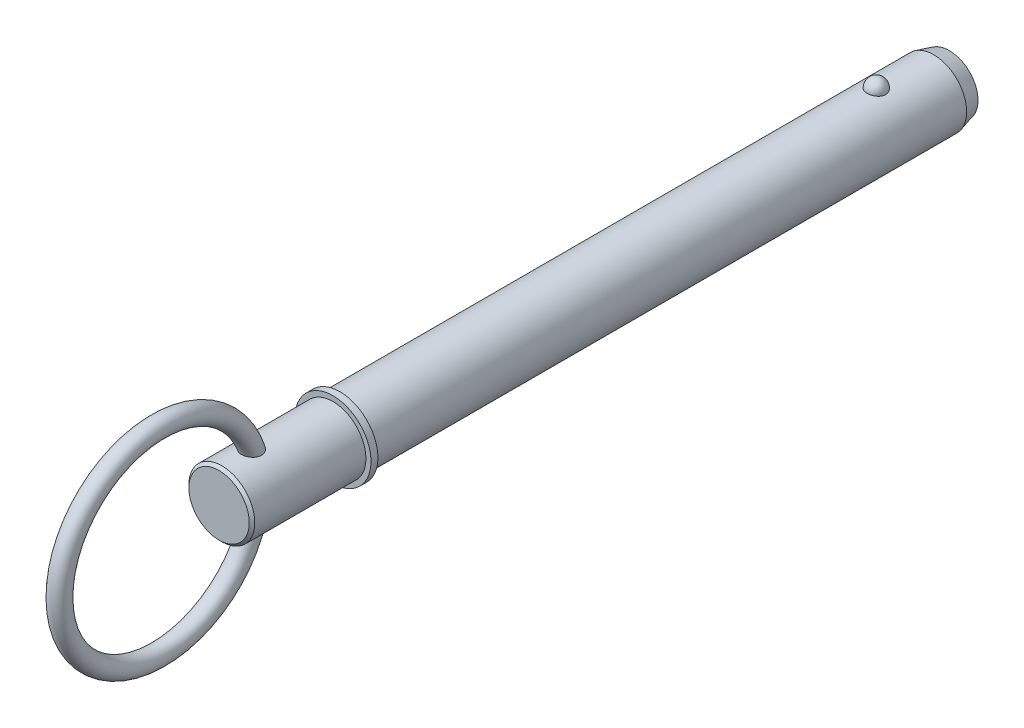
SolidWorks part; units mm, degrees
ref_plane "Front Plane" through (0, 0, 0) normal (0, 0, 1) x (1, 0, 0)
ref_plane "Top Plane" through (0, 0, 0) normal (0, 1, 0) x (1, 0, 0)
ref_plane "Right Plane" through (0, 0, 0) normal (1, 0, 0) x (0, 0, -1)
sketch "Sketch2" plane through (0, 0, 0) normal (0, 0, 1) x (1, 0, 0)
  circle A0 centre (0, 0) radius 9.525
  point P3 (0, 9.525)
  dimension "D1" = 19.05
extrude "Boss-Extrude1" add sketch "Sketch2" along normal blind 152.4
sketch "Sketch3" plane through (0, 0, 0) normal (0, 0, -1) x (-1, 0, 0)
  circle A0 centre (0, 0) radius 9.525
  dimension "D1" = 19.05
extrude "Boss-Extrude2" add sketch "Sketch3" along normal blind 23.8
chamfer "Chamfer1" distance 4.5 angle 15 1 edges at (-9.525, 0, -23.8)
sketch "Sketch18" plane through (0, 0, 0) normal (1, 0, 0) x (0, 0, -1)
  line L0 (19.3, 9.525) -> (-152.4, 9.525) construction
  line L1 (2.69, 12.215) -> (2.69, 6.835)
  line L2 (-152.4, -9.525) -> (19.3, -9.525) construction
  arc A0 (2.69, 12.215) -> (2.69, 6.835) centre (2.69, 9.525) ccw
  point P4 (0, 9.525)
  dimension "D1" = 21.74
revolve "Revolve1" add sketch "Sketch18" angle 360 about L1
sketch "Sketch19" plane through (0, 0, 0) normal (1, 0, 0) x (0, 0, -1)
  line L0 (-33.7288, 0) -> (-46.4542, 0) construction
sketch "Sketch20" plane through (0, 0, 0) normal (1, 0, 0) x (0, 0, -1)
  line L0 (-152.4, 0) -> (-152.4, 11)
  line L1 (-152.4, 9.525) -> (-152.4, -9.525) construction
  line L2 (-152.4, 11) -> (-154.4, 11)
  line L3 (-154.4, 11) -> (-154.4, 0)
  line L4 (-33.7288, 0) -> (-46.4542, 0) construction
  line L5 (-154.4, 0) -> (-152.4, 0)
  dimension "D1" = 11
  dimension "D2" = 2
revolve "Revolve2" add sketch "Sketch20" angle 360 about L0
sketch "Sketch21" plane through (0, 0, 152.4) normal (0, 0, -1) x (-1, 0, 0)
  circle A0 centre (0, 0) radius 9.525
  dimension "D1" = 19.05
extrude "Boss-Extrude3" add sketch "Sketch21" against normal blind 34.93
chamfer "Chamfer2" distance 0.8 angle 45 1 edges at (-9.525, 0, 187.33)
sketch "Sketch23" plane through (0, 0, 0) normal (1, 0, 0) x (0, 0, -1)
  line L0 (-187.33, 8.725) -> (-187.33, -8.725) construction
  circle A0 centre (-204.905, 0) radius 28.575
  point P2 (-176.33, 0)
  dimension "D1" = 57.15
  dimension "D2" = 11
sketch "Sketch24" plane through (0, 0, 0) normal (0, 1, 0) x (1, 0, 0)
  circle A0 centre (0, -176.33) radius 2.75
  dimension "D1" = 5.5
sweep "Sweep1" add profiles "Sketch24" path "Sketch23"
